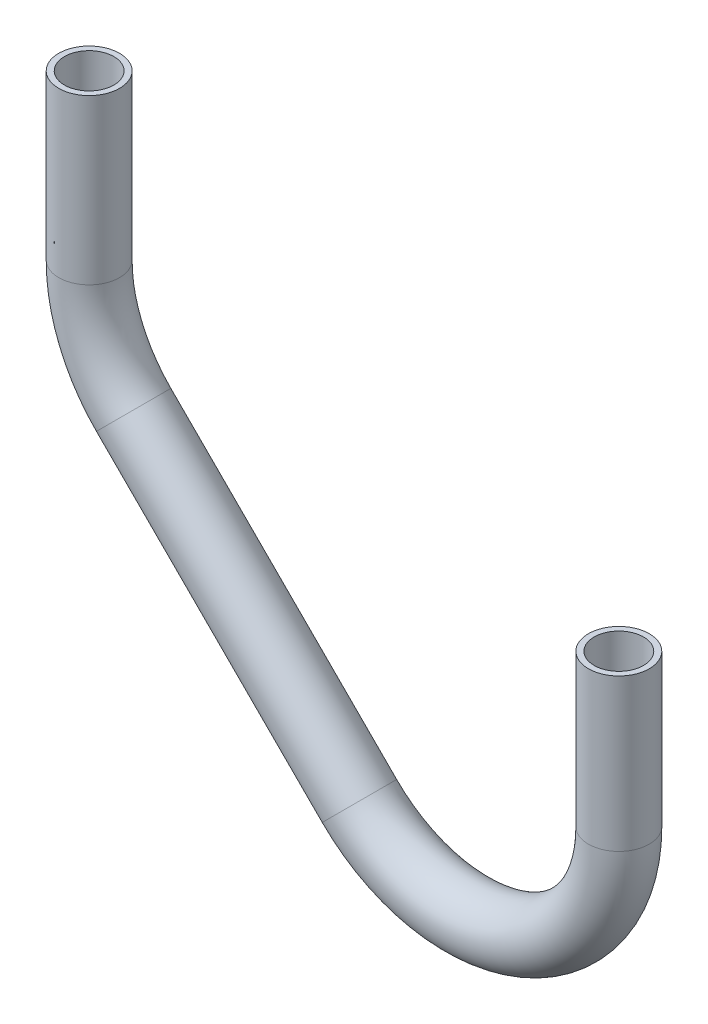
SolidWorks part; units mm, degrees
ref_plane "Front Plane" through (0, 0, 0) normal (0, 0, 1) x (1, 0, 0)
ref_plane "Top Plane" through (0, 0, 0) normal (0, 1, 0) x (1, 0, 0)
ref_plane "Right Plane" through (0, 0, 0) normal (1, 0, 0) x (0, 0, -1)
sketch "Sketch1" plane through (0, 0, 0) normal (0, 0, 1) x (1, 0, 0)
  line L0 (0, 0) -> (0, -23.8125)
  line L1 (-83.0119, 11.5744) -> (-83.0119, 37.2643)
  line L2 (-76.0373, -5.2636) -> (-40.6505, -40.6505)
  line L3 (0, 0) -> (-46.6525, 0) construction
  line L4 (1.5875, 0) -> (1.5875, -23.8125) construction
  line L5 (-84.5994, 37.2643) -> (-84.5994, 11.5744) construction
  line L6 (-83.0119, 20.5003) -> (-83.0119, 37.2643) construction
  line L7 (-86.5679, 37.2643) -> (-79.4559, 37.2643) construction
  line L8 (-77.1599, -6.3861) -> (-41.773, -41.773) construction
  line L9 (-40.6505, -40.6505) -> (-41.773, -41.773) construction
  line L10 (1.5875, -23.8125) -> (0, -23.8125) construction
  line L11 (-76.0373, -5.2636) -> (-77.1599, -6.3861) construction
  arc A0 (-76.0373, -5.2636) -> (-83.0119, 11.5744) centre (-59.1994, 11.5744) cw
  arc A1 (0, -23.8125) -> (-40.6505, -40.6505) centre (-23.8125, -23.8125) cw
  arc A2 (1.5875, -23.8125) -> (-41.773, -41.773) centre (-23.8125, -23.8125) cw construction
  arc A3 (-77.1599, -6.3861) -> (-84.5994, 11.5744) centre (-59.1994, 11.5744) cw construction
  dimension "D1" = 23.8125
  dimension "D4" = 25.4
  dimension "D2" = 45
  dimension "D3" = 23.8125
  dimension "D5" = 86.1869
sketch "Sketch2" plane through (0, 0, 0) normal (0, 1, 0) x (0, 0, -1)
  circle A0 centre (0, 0) radius 4.7625
  circle A1 centre (0, 0) radius 3.8735
  dimension "D1" = 0.889
  dimension "D2" = 9.525
sweep "Sweep1" add profiles "Sketch2" path "Sketch1"
